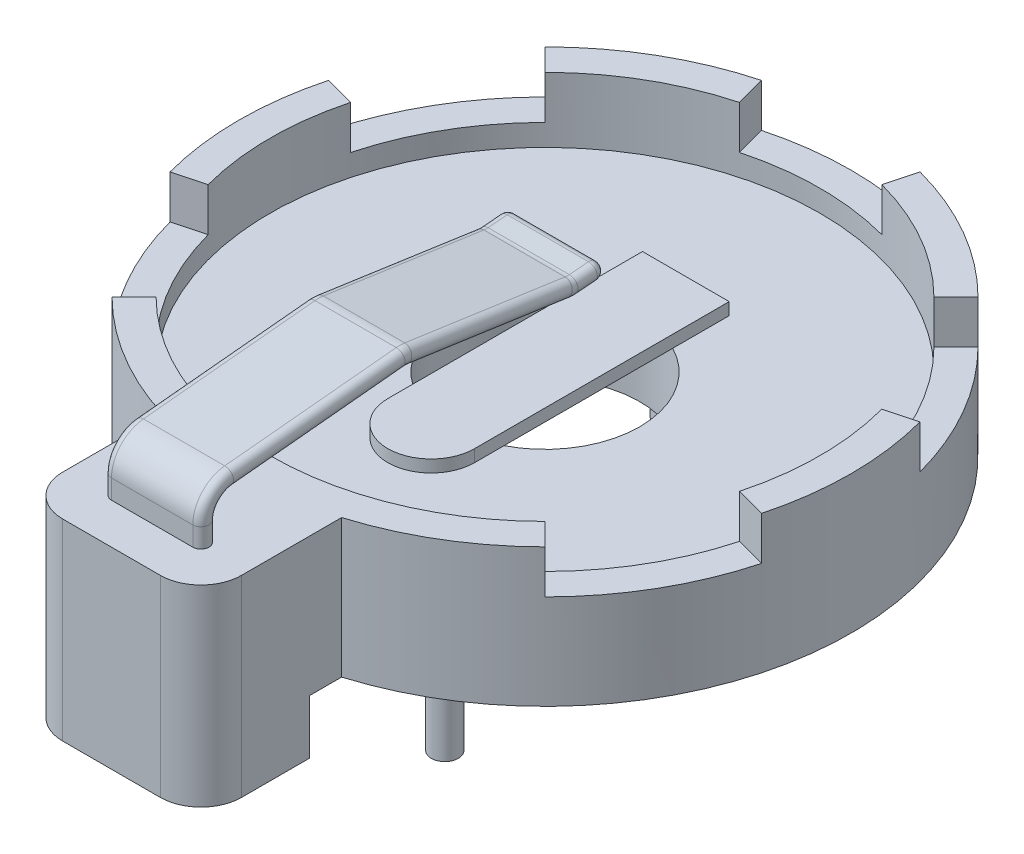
SolidWorks part; units mm, degrees
ref_plane "Plan de face" through (0, 0, 0) normal (0, 0, 1) x (1, 0, 0)
ref_plane "Plan de dessus" through (0, 0, 0) normal (0, 1, 0) x (1, 0, 0)
ref_plane "Plan de droite" through (0, 0, 0) normal (1, 0, 0) x (0, 0, -1)
sketch "Esquisse1" plane through (0, 0, 0) normal (0, 1, 0) x (1, 0, 0)
  line L0 (0, -13.3024) -> (0, -5.7962) construction
  line L1 (3.3, -16.8889) -> (3.3, -3.78) construction
  line L2 (-3.3, -16.8889) -> (-3.3, -3.78) construction
  line L3 (-3.9085, -16) -> (18.5429, -16) construction
  line L4 (5.3465, -11.3) -> (18.5429, -11.3) construction
  line L7 (-3.3, -10.8074) -> (-3.3, -14.5)
  line L8 (-1.8, -16) -> (1.8, -16)
  line L9 (3.3, -10.8074) -> (3.3, -14.5)
  arc A0 (3.3, -10.8074) -> (-3.3, -10.8074) centre (0, 0) ccw
  arc A1 (-3.3, -14.5) -> (-1.8, -16) centre (-1.8, -14.5) ccw
  arc A2 (1.8, -16) -> (3.3, -14.5) centre (1.8, -14.5) ccw
  circle A3 centre (0, 0) radius 3.5
  point P20 (3.3, -16)
  dimension "D1" = 3.3
  dimension "D4" = 1.5
  dimension "D2" = 6.6
  dimension "D3" = 4.7
extrude "Boss.-Extru.1" add sketch "Esquisse1" along normal blind 5.1
sketch "Esquisse2" plane through (0, 5.1, 0) normal (0, 1, 0) x (1, 0, 0)
  circle A0 centre (0, 0) radius 10.15
extrude "Enlèv. mat.-Extru.1" cut sketch "Esquisse2" against normal blind 2.4
sketch "Esquisse3" plane through (0, 5.1, 0) normal (0, 1, 0) x (1, 0, 0)
  line L0 (0, 0) -> (0, 12.1376) construction
  line L1 (0, 0) -> (-3.1865, 11.892) construction
  line L2 (0, 0) -> (3.178, 11.8603) construction
  line L3 (-2.9635, 11.06) -> (-2.5882, 9.6593)
  line L4 (2.9635, 11.06) -> (2.5882, 9.6593)
  line L5 (8.0965, 8.0965) -> (7.0711, 7.0711)
  line L6 (11.06, 2.9635) -> (9.6593, 2.5882)
  line L7 (11.06, -2.9635) -> (9.6593, -2.5882)
  line L8 (8.0965, -8.0965) -> (7.0711, -7.0711)
  line L11 (-8.0965, -8.0965) -> (-7.0711, -7.0711)
  line L12 (-11.06, -2.9635) -> (-9.6593, -2.5882)
  line L13 (-11.06, 2.9635) -> (-9.6593, 2.5882)
  line L14 (-8.0965, 8.0965) -> (-7.0711, 7.0711)
  line L15 (2.9635, -11.06) -> (2.5882, -9.6593)
  line L16 (-2.9635, -11.06) -> (-2.5882, -9.6593)
  arc A0 (2.5882, 9.6593) -> (-2.5882, 9.6593) centre (0, 0) ccw
  arc A1 (2.9635, 11.06) -> (-2.9635, 11.06) centre (0, 0) ccw
  arc A2 (9.6593, 2.5882) -> (7.0711, 7.0711) centre (0, 0) ccw
  arc A3 (11.06, 2.9635) -> (8.0965, 8.0965) centre (0, 0) ccw
  arc A4 (7.0711, -7.0711) -> (9.6593, -2.5882) centre (0, 0) ccw
  arc A5 (8.0965, -8.0965) -> (11.06, -2.9635) centre (0, 0) ccw
  arc A8 (-9.6593, -2.5882) -> (-7.0711, -7.0711) centre (0, 0) ccw
  arc A9 (-11.06, -2.9635) -> (-8.0965, -8.0965) centre (0, 0) ccw
  arc A10 (-7.0711, 7.0711) -> (-9.6593, 2.5882) centre (0, 0) ccw
  arc A11 (-8.0965, 8.0965) -> (-11.06, 2.9635) centre (0, 0) ccw
  arc A12 (-2.5882, -9.6593) -> (2.5882, -9.6593) centre (0, 0) ccw
  arc A13 (-2.9635, -11.06) -> (2.9635, -11.06) centre (0, 0) ccw
  dimension "D3" = 6
  dimension "D1" = 15
  dimension "D2" = 15
extrude "Enlèv. mat.-Extru.2" cut sketch "Esquisse3" against normal blind 1.6
sketch "Esquisse4" plane through (0, 0, 0) normal (0, -1, 0) x (1, 0, 0)
  line L0 (1.9592, 0) -> (-14.5048, 0) construction
  circle A0 centre (0, 0) radius 10.1052 construction
  circle A1 centre (-10.1052, 0) radius 0.5
  circle A2 centre (5.0526, 8.7514) radius 0.5
  circle A3 centre (5.0526, -8.7514) radius 0.5
  dimension "D1" = 3
extrude "Boss.-Extru.2" add sketch "Esquisse4" along normal blind 2.5
sketch "Esquisse5" plane through (0, 0, 0) normal (0, -1, 0) x (1, 0, 0)
  line L0 (0, -9.9327) -> (0, 17.1431) construction
  line L1 (-1.8, 16.6969) -> (-1.8, 13.8626) construction
  line L2 (-5.5747, 16) -> (4.051, 16) construction
  line L3 (-3.859, 14.5) -> (-1.3648, 14.5) construction
  line L4 (-4.7282, 13) -> (6.5207, 13) construction
  line L5 (4.051, 12) -> (-5.5747, 12) construction
  line L6 (-3.3, 14.5) -> (-3.3, 12)
  line L7 (-1.8, 16) -> (1.8, 16)
  line L8 (3.3, 14.5) -> (3.3, 12)
  line L9 (3.3, 14.5) -> (3.3, 10.8074) construction
  line L10 (3.3, 12) -> (-3.3, 12)
  line L12 (4.4545, 13.3) -> (17.3402, 13.3) construction
  line L13 (17.3402, -6.7) -> (-4.7282, -6.7) construction
  arc A0 (-1.8, 16) -> (-3.3, 14.5) centre (-1.8, 14.5) ccw
  arc A1 (1.8, 16) -> (3.3, 14.5) centre (1.8, 14.5) cw
  circle A2 centre (0, -6.7) radius 2
  dimension "D1" = 3
  dimension "D2" = 4
  dimension "D3" = 0.3
  dimension "D4" = 20
extrude "Boss.-Extru.3" add sketch "Esquisse5" along normal blind 2
sketch "Esquisse6" plane through (0, -2, 0) normal (0, -1, 0) x (1, 0, 0)
  line L0 (0, -12.0872) -> (0, 16.619) construction
  line L1 (16.839, -6.7) -> (-1.3699, -6.7) construction
  line L2 (16.839, 13.3) -> (-1.3699, 13.3) construction
  circle A0 centre (0, -6.7) radius 0.55
  circle A1 centre (0, 13.3) radius 0.55
  dimension "D1" = 20
extrude "Boss.-Extru.4" add sketch "Esquisse6" along normal blind 2.1
sketch "Esquisse7" plane through (0, 2.7, 0) normal (0, 1, 0) x (1, 0, 0)
  line L0 (0, -6.4126) -> (0, 5.9088) construction
  line L1 (7.5537, 5.1985) -> (-2.6121, 5.1985) construction
  line L2 (-1.6, 5.9088) -> (-1.6, -6.4126) construction
  line L3 (1.6, 5.9088) -> (1.6, -6.4126) construction
  line L4 (7.0638, -5.8015) -> (-3.0776, -5.8015) construction
  line L5 (-1.6, -4.2015) -> (-1.6, 5.1985)
  line L6 (-1.6, 5.1985) -> (1.6, 5.1985)
  line L7 (1.6, 5.1985) -> (1.6, -4.2015)
  arc A0 (-1.6, -4.2015) -> (1.6, -4.2015) centre (0, -4.2015) ccw
  dimension "D1" = 1.6
  dimension "D2" = 1.6
  dimension "D3" = 11
extrude "Boss.-Extru.5" add sketch "Esquisse7" along normal blind 0.45
sketch "Esquisse8" plane through (0, 5.1, 0) normal (0, 1, 0) x (1, 0, 0)
  line L0 (0, -17.0266) -> (0, -9.5127) construction
  line L1 (4.5796, -14.5) -> (-3.6694, -14.5) construction
  line L2 (-3.6694, -13.9) -> (4.5796, -13.9) construction
  line L3 (1.8, -16.7653) -> (1.8, -11.8485) construction
  line L4 (-1.8, -16.7653) -> (-1.8, -11.8485) construction
  line L5 (-1.8, -16) -> (1.8, -16) construction
  line L6 (-2.1096, -14.2) -> (0.5713, -14.2) construction
  line L7 (-1.5, -14.5) -> (1.5, -14.5)
  line L8 (-1.5, -13.9) -> (1.5, -13.9)
  arc A0 (-1.5, -13.9) -> (-1.5, -14.5) centre (-1.5, -14.2) ccw
  arc A1 (1.5, -13.9) -> (1.5, -14.5) centre (1.5, -14.2) cw
  dimension "D1" = 0.6
  dimension "D2" = 1.5
  dimension "D3" = 1.8
  dimension "D4" = 3.6
  dimension "D5" = 0.3
ref_plane "Plan1" through (0, 0, 0) normal (1, 0, 0) x (0, 0, -1)
sketch "Esquisse9" plane through (0, 0, 0) normal (1, 0, 0) x (0, 0, -1)
  line L0 (-14.1953, 5.1) -> (-14.1953, 5.8118)
  line L1 (-17.0266, 5.1) -> (-9.5127, 5.1) construction
  line L2 (-13.2921, 6.8071) -> (-6.9605, 7.4224)
  line L3 (-6.7215, 7.417) -> (-0.8016, 6.5661)
  line L4 (-0.5774, 6.5593) -> (0.4201, 6.6413)
  arc A0 (-14.1953, 5.8118) -> (-13.2921, 6.8071) centre (-13.1953, 5.8118) cw
  arc A1 (-6.9605, 7.4224) -> (-6.7215, 7.417) centre (-6.8638, 6.4271) cw
  arc A2 (-0.8016, 6.5661) -> (-0.5774, 6.5593) centre (-0.6593, 7.5559) ccw
  dimension "D1" = 1
sweep "Balayage1" add profiles "Esquisse8" path "Esquisse9"
fillet "Congé1" radius 0.29 4 edges at (-1.8, 6.6459, -0.4197) (0, 6.3469, -0.4443) (1.8, 6.6459, -0.4197) (0, 6.9449, -0.3951)
